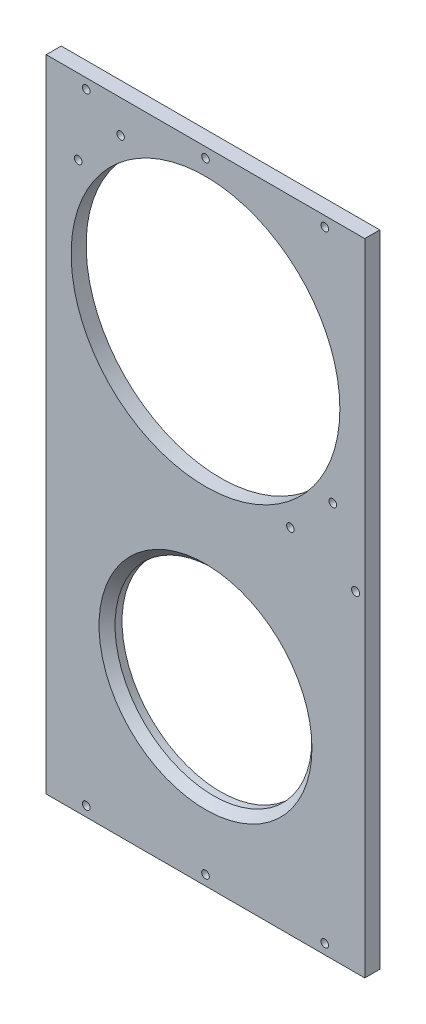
SolidWorks part; units mm, degrees
ref_plane "Front Plane" through (0, 0, 0) normal (0, 0, 1) x (1, 0, 0)
ref_plane "Top Plane" through (0, 0, 0) normal (0, 1, 0) x (1, 0, 0)
ref_plane "Right Plane" through (0, 0, 0) normal (1, 0, 0) x (0, 0, -1)
sketch "Sketch1" plane through (0, 0, 0) normal (0, 0, 1) x (1, 0, 0)
  line L1 (-202.184, 0) -> (0, 0)
  line L2 (-202.184, 0) -> (-202.184, -406.4)
  line L3 (-202.184, -406.4) -> (0, -406.4)
  line L4 (0, 0) -> (0, -406.4)
  dimension "D1" = 202.184
  dimension "D3" = 406.4
extrude "plate" add sketch "Sketch1" along normal blind 9.525
sketch "Sketch2" plane through (0, 0, 9.525) normal (0, 0, 1) x (1, 0, 0)
  line L0 (-101.092, 0) -> (-101.092, -340.4304) construction
  line L1 (0, 0) -> (-202.184, 0) construction
  line L2 (-202.184, -406.4) -> (0, -406.4) construction
  circle A0 centre (-101.092, -296.8625) radius 62.484
  circle A1 centre (-101.092, -101.6) radius 85.2805
  dimension "D1" = 124.968
  dimension "D2" = 170.561
  dimension "D3" = 101.6
  dimension "D4" = 109.5375
extrude "holes" cut sketch "Sketch2" against normal through all
sketch "Sketch6" plane through (0, 0, 0) normal (0, 0, -1) x (-1, 0, 0)
  line L0 (202.184, -406.4) -> (0, -406.4) construction
  line L1 (12.192, -203.2) -> (189.992, -203.2)
  line L2 (12.192, -203.2) -> (12.192, -215.9)
  line L3 (12.192, -215.9) -> (189.992, -215.9)
  line L4 (189.992, -203.2) -> (189.992, -215.9)
  point P6 (101.092, -406.4)
  point P7 (101.092, -215.9)
  dimension "D1" = 12.7
  dimension "D2" = 177.8
  dimension "D3" = 203.2
extrude "Cut-Extrude2" [suppressed] cut sketch "Sketch6" against normal through all
chamfer "Chamfer1" distance 5.08 angle 45 1 edges at (-38.608, -296.8625, 9.525)
sketch "Sketch3" plane through (0, 0, 9.525) normal (0, 0, 1) x (1, 0, 0)
  line L0 (-101.092, -101.6) -> (-101.092, 18.8467) construction
  line L1 (-101.092, -101.6) -> (-218.5829, 15.8909) construction
  line L2 (-218.5829, 15.8909) -> (46.9986, -249.6906) construction
  line L3 (-149.0395, -14.8437) -> (-186.1073, -51.9114) construction
  line L4 (-20.2697, -155.4815) -> (-53.701, -188.9129) construction
  line L5 (-186.0601, 10.3088) -> (15.5148, -191.2661) construction
  line L6 (-199.2153, -30.4175) -> (-17.7532, -211.8795) construction
  circle A0 centre (-154.9735, -20.7777) radius 2.413
  circle A1 centre (-181.9143, -47.7185) radius 2.413
  circle A2 centre (-47.2105, -182.4223) radius 2.413
  circle A3 centre (-20.2697, -155.4815) radius 2.413
  dimension "D8" = 4.826
  dimension "D9" = 4.826
  dimension "D10" = 4.826
  dimension "D11" = 4.826
  dimension "D1" = 45
  dimension "D2" = 90
  dimension "D3" = 90
  dimension "D4" = 95.25
  dimension "D5" = 95.25
  dimension "D6" = 19.05
  dimension "D7" = 38.1
extrude "glass retainer mounting" cut sketch "Sketch3" against normal through all
sketch "Sketch4" plane through (0, 0, 9.525) normal (0, 0, 1) x (1, 0, 0)
  line L0 (-233.4466, -6.35) -> (47.5006, -6.35) construction
  line L1 (-219.9661, -400.05) -> (47.5006, -400.05) construction
  line L2 (-176.784, 12.934) -> (-176.784, -398.2233) construction
  line L3 (-25.4, 12.934) -> (-25.4, -398.2233) construction
  line L4 (-101.092, 12.934) -> (-101.092, -101.6) construction
  line L5 (-202.184, 0) -> (-202.184, -406.4) construction
  line L6 (0, -406.4) -> (0, 0) construction
  line L7 (-101.092, -101.6) -> (-101.092, -391.7894) construction
  line L8 (0, 0) -> (-202.184, 0) construction
  line L9 (-202.184, -406.4) -> (0, -406.4) construction
  circle A1 centre (-176.784, -6.35) radius 2.413
  circle A2 centre (-101.092, -6.35) radius 2.413
  circle A3 centre (-25.4, -6.35) radius 2.413
  circle A4 centre (-176.784, -400.05) radius 2.413
  circle A5 centre (-101.092, -400.05) radius 2.413
  circle A6 centre (-25.4, -400.05) radius 2.413
  dimension "D5" = 4.826
  dimension "D6" = 4.826
  dimension "D7" = 4.826
  dimension "D8" = 4.826
  dimension "D9" = 4.826
  dimension "D10" = 4.826
  dimension "D1" = 25.4
  dimension "D2" = 25.4
  dimension "D3" = 6.35
  dimension "D4" = 6.35
extrude "end stop holes" cut sketch "Sketch4" against normal through all
sketch "Sketch5" plane through (0, 0, 9.525) normal (0, 0, 1) x (1, 0, 0)
  line L0 (-5.842, -203.3179) -> (-5.842, -233.1706) construction
  line L1 (0.508, -203.3179) -> (-12.192, -203.3179) construction
  line L2 (-202.184, -406.4) -> (0, -406.4) construction
  circle A0 centre (-5.842, -196.85) radius 2.54
  dimension "D1" = 5.08
  dimension "D2" = 209.55
extrude "Cut-Extrude1" cut sketch "Sketch5" against normal through all
